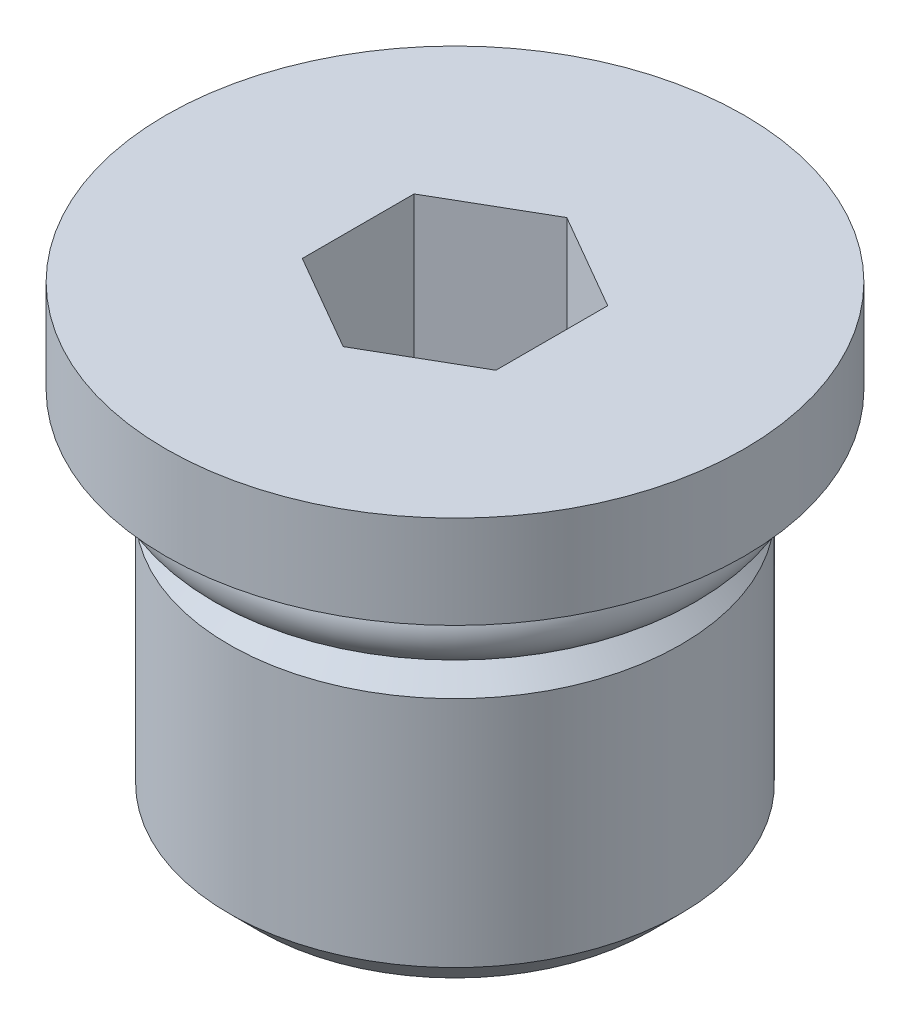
SolidWorks part; units mm, degrees
ref_plane "Front" through (0, 0, 0) normal (0, 0, 1) x (1, 0, 0)
ref_plane "Top" through (0, 0, 0) normal (0, 1, 0) x (1, 0, 0)
ref_plane "Right" through (0, 0, 0) normal (1, 0, 0) x (0, 0, -1)
sketch "Sketch1" plane through (0, 0, 0) normal (0, 0, 1) x (1, 0, 0)
  line L0 (4.8006, -1.905) -> (5.5562, -2.6606)
  line L1 (5.5562, -2.6606) -> (5.5563, -8.3883)
  line L2 (5.5563, -8.3883) -> (4.8006, -9.144)
  line L3 (4.8006, -9.144) -> (0, -9.144)
  line L4 (0, -9.144) -> (0, 2.286)
  line L5 (0, 2.286) -> (7.112, 2.286)
  line L6 (7.112, 2.286) -> (7.112, 0)
  line L7 (7.112, 0) -> (4.8006, 0)
  line L8 (4.8006, 0) -> (4.8006, -1.905)
  line L9 (0, 0) -> (0, 9.9141) construction
  dimension "D1" = 2.286
  dimension "D2" = 7.112
  dimension "D3" = 4.8006
  dimension "D4" = 5.5562
  dimension "D5" = 135
  dimension "D6" = 11.43
  dimension "D7" = 7.239
revolve "Revolve1" add sketch "Sketch1" angle 360 about L9
sketch "Sketch2" plane through (0, 2.286, 0) normal (0, 1, 0) x (-1, 0, 0)
  line L1 (0, -2.7496) -> (2.3813, -1.3748)
  line L2 (2.3813, -1.3748) -> (2.3813, 1.3748)
  line L3 (2.3813, 1.3748) -> (0, 2.7496)
  line L4 (0, 2.7496) -> (-2.3813, 1.3748)
  line L5 (-2.3813, 1.3748) -> (-2.3813, -1.3748)
  line L6 (-2.3813, -1.3748) -> (0, -2.7496)
  circle A0 centre (0, 0) radius 2.3813 construction
  dimension "D1" = 4.7625
extrude "Cut-Extrude1" cut sketch "Sketch2" against normal blind 4.7625
sketch "Sketch3" plane through (0, 0, 0) normal (0, 0, 1) x (1, 0, 0)
  line L1 (0, 0) -> (0, -1.6577) construction
  circle A0 centre (5.2832, -0.9271) radius 0.9017
  dimension "D2" = 1.8034
  dimension "D1" = 4.3815
  dimension "D3" = 0.0254
revolve "Revolve3" add sketch "Sketch3" angle 360 about L1
